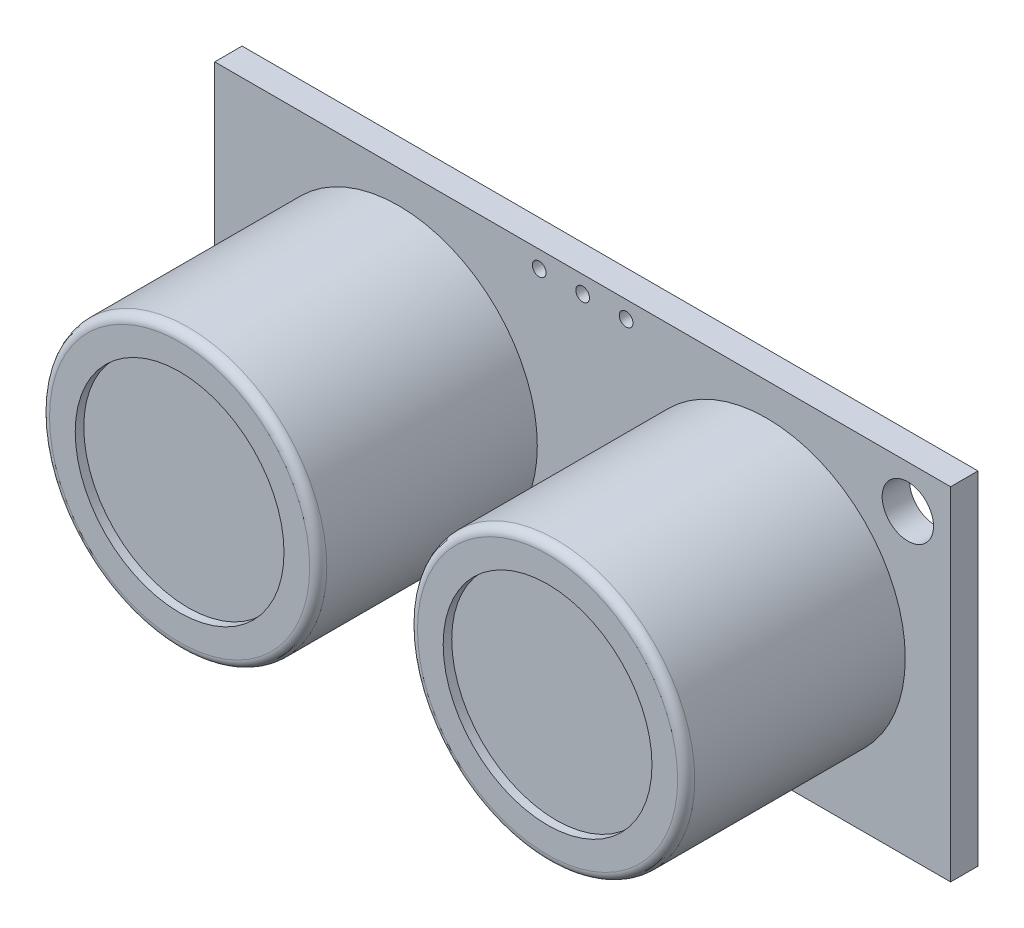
SolidWorks part; units mm, degrees
ref_plane "Plan de face" through (0, 0, 0) normal (0, 0, 1) x (1, 0, 0)
ref_plane "Plan de dessus" through (0, 0, 0) normal (0, 1, 0) x (1, 0, 0)
ref_plane "Plan de droite" through (0, 0, 0) normal (1, 0, 0) x (0, 0, -1)
sketch "Esquisse1" plane through (0, 0, 0) normal (0, 0, 1) x (1, 0, 0)
  line L0 (21.5, 27.1461) -> (21.5, -5.7816) construction
  line L1 (0, 0) -> (43, 0)
  line L2 (0, 0) -> (0, 20)
  line L3 (0, 20) -> (43, 20)
  line L4 (43, 0) -> (43, 20)
  line L5 (55.0733, 0) -> (-1.9588, 0) construction
  line L6 (55.0733, 10) -> (24.8466, 10) construction
  line L7 (0, -5.7816) -> (0, 25.8466) construction
  line L8 (2.5, -5.7816) -> (2.5, 3.5984) construction
  line L9 (-1.9588, 2.5) -> (6.2168, 2.5) construction
  line L10 (32.25, -5.7816) -> (32.25, 12.1194) construction
  line L11 (44.9003, 1.3) -> (12.1151, 1.3) construction
  line L12 (28.0751, 19) -> (9.6828, 19) construction
  line L13 (18.96, 13.4738) -> (18.96, 20.8397) construction
  circle A0 centre (2.5, 2.5) radius 1.5
  circle A1 centre (21.5, 19) radius 0.4
  circle A2 centre (40.5, 17.5) radius 1.5
  circle A3 centre (18.96, 19) radius 0.4
  circle A4 centre (24.04, 19) radius 0.4
  dimension "D5" = 10.75
  dimension "D6" = 1.3
  dimension "D7" = 2
  dimension "D8" = 2.54
  dimension "D1" = 21.5
  dimension "D2" = 10
  dimension "D3" = 2.5
  dimension "D4" = 2.5
extrude "Extrusion1" add sketch "Esquisse1" along normal blind 1.6
sketch "Esquisse2" plane through (0, 0, 1.6) normal (0, 0, 1) x (1, 0, 0)
  line L0 (45.5442, 10) -> (26.9424, 10) construction
  line L1 (32.25, 21.9612) -> (32.25, 8.0302) construction
  line L2 (0, 0) -> (43, 0) construction
  line L3 (43, 0) -> (43, 20) construction
  circle A0 centre (32.25, 10) radius 8.1
  dimension "D1" = 10
  dimension "D2" = 10.75
extrude "Extrusion2" add sketch "Esquisse2" along normal blind 12.8
sketch "Esquisse3" plane through (0, 0, 14.4) normal (0, 0, 1) x (1, 0, 0)
  circle A0 centre (32.25, 10) radius 6.1
extrude "Enlèv. mat.-Extru.1" cut sketch "Esquisse3" against normal blind 0.5
fillet "Congé1" radius 0.5 1 edges at (40.35, 10, 14.4)
ref_plane "Plan1" through (21.5, 0, 0) normal (1, 0, 0) x (0, 0, -1)
mirror "Symétrie1" about plane through (21.5, 0, 0) normal (1, 0, 0) of "Extrusion2", "Enlèv. mat.-Extru.1", "Congé1"
